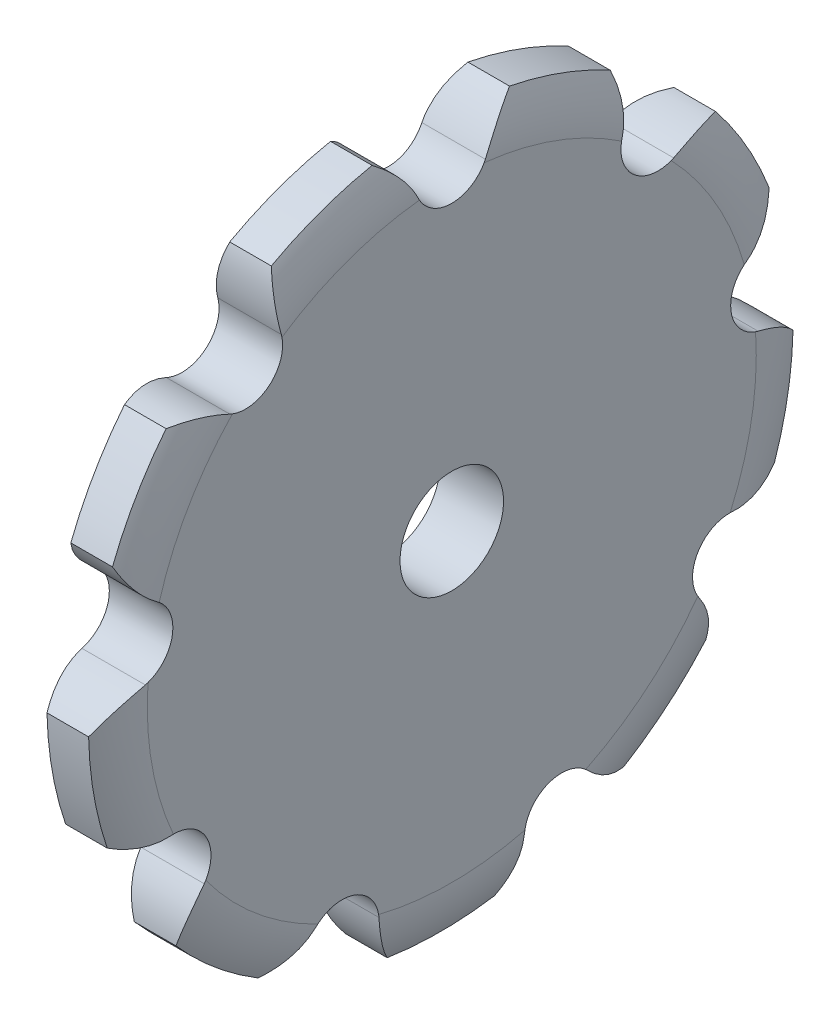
SolidWorks part; units mm, degrees
ref_plane "Plane1" through (0, 0, 0) normal (0, 0, 1) x (1, 0, 0)
ref_plane "Plane2" through (0, 0, 0) normal (0, 1, 0) x (1, 0, 0)
ref_plane "Plane3" through (0, 0, 0) normal (1, 0, 0) x (0, 0, -1)
sketch "Clipboard" plane through (0, 0, 0) normal (0, 1, 0) x (1, 0, 0)
  line L0 (0, 0) -> (25.0873, -3.9734)
  line L1 (-15, 0) -> (100, 0) construction
  line L2 (0, 0) -> (-0.8416, 0.9512)
  line L3 (0, 0) -> (-11.863, 4.5341)
  line L4 (0, 0) -> (3.0618, 0.4849)
  line L5 (0, 0) -> (-2.8109, -1.0484)
  line L6 (0, 0) -> (-6.1032, -4.1179)
  line L7 (-0.8416, 0.9512) -> (9.364, 2.7507)
  line L8 (-76.2, 38.1) -> (-75.2, 38.1)
  line L9 (-73.4361, 41.7391) -> (-72.4443, 41.8673)
  line L10 (-73.4741, 12.7512) -> (-59.5541, 12.7512)
  line L11 (-73.4741, 12.7512) -> (-59.1042, 12.5003)
  line L12 (-147.5013, -35.8225) -> (-147.5932, -35.8997)
  circle A0 centre (0, 0) radius 4.255
  circle A1 centre (0, 0) radius 25
  circle A2 centre (0, 0) radius 25
  dimension "Dr" = 8.51
  dimension "MHD" = 50
  dimension "Hub_dia" = 50
  dimension "Num_teeth" = 9
  dimension "Pitch" = 25.4
  dimension "Width" = 3.1
  dimension "Side_relief" = 1.27
  dimension "Side_radius" = 12.7
  dimension "Overall_len" = 3
  dimension "Show_teeth" = 9
  dimension "Thickness" = 7.3625
  dimension "OAL" = 10.363
  dimension "T_dim" = 1
  dimension "Fillet_rad" = 1
  dimension "Face_width" = 7.363
  dimension "Num_strands" = 1
  dimension "Transv_pitch" = 13.92
  dimension "Plate_wid" = 11.8
  dimension "Cut" = 1
  dimension "GapFactor" = 0.12
  dimension "GapAngle" = 140
sketch "BasProSke" plane through (0, 0, 0) normal (0, 1, 0) x (1, 0, 0)
  line L0 (-10, 0) -> (60, 0) construction
  line L1 (0, 0) -> (0, 35.279)
  line L2 (0, 0) -> (7.3625, 0)
  line L3 (7.3625, 0) -> (7.3625, 35.279)
  line L4 (6.0925, 40.8148) -> (1.27, 40.8148)
  arc A0 (0, 35.279) -> (1.27, 40.8148) centre (12.7, 35.279) cw
  arc A1 (7.3625, 35.279) -> (6.0925, 40.8148) centre (-5.3375, 35.279) ccw
  dimension "D1" = 12.7
  dimension "G1" = 1.27
  dimension "G2" = 1.27
  dimension "Diameter" = 81.6296
  dimension "Thickness" = 7.3625
revolve "Base-Revolve" add sketch "BasProSke" angle 360 about L0
sketch "TooCutSke" plane through (0, 0, 0) normal (1, 0, 0) x (0, 0, -1)
  line L0 (0, 37.1749) -> (3.8949, 35.3586) construction
  line L1 (0, 0) -> (0, 107) construction
  line L2 (0, 37.1749) -> (-10, 37.1749) construction
  line L3 (0, 37.1749) -> (-3.8949, 35.3586) construction
  arc A0 (3.8949, 35.3586) -> (7.9688, 40.0395) centre (14.0756, 30.6113) cw
  arc A1 (3.8949, 35.3586) -> (-3.8949, 35.3586) centre (0, 37.1749) cw
  arc A2 (-3.8949, 35.3586) -> (-7.9688, 40.0395) centre (-14.0756, 30.6113) ccw
  arc A3 (7.9688, 40.0395) -> (-7.9688, 40.0395) centre (0, 0) ccw
  dimension "R1" = 4.2976
  dimension "R2" = 11.2332
  dimension "Overcut" = 40.8248
  dimension "Seat_radius" = 37.1749
  dimension "X" = 130
extrude "ToothCut" cut sketch "TooCutSke" along normal through all
pattern_circular "TeethCuts" count 9 every 40 about axis through (-10, 0, 0) along (1, 0, 0) of "ToothCut"
sketch "HubNeaOneSke" plane through (0, 0, 0) normal (-1, 0, 0) x (0, 0, 1)
  circle A0 centre (0, 0) radius 25
  dimension "Diameter" = 50
extrude "HubNearOne" [suppressed] add sketch "HubNeaOneSke" along normal blind 3.0005
fillet "HubNearOneFillet" [suppressed] radius 1
sketch "HubNeaBotSke" plane through (0, 0, 0) normal (-1, 0, 0) x (0, 0, 1)
  circle A0 centre (0, 0) radius 25
  dimension "Diameter" = 50
extrude "HubNearBoth" [suppressed] add sketch "HubNeaBotSke" along normal blind 1.5003
fillet "HubNearBothFillet" [suppressed] radius 1
ref_plane "FarPln" through (7.3625, 0, 0) normal (1, 0, 0) x (0, 0, -1)
sketch "HubFarSke" plane through (7.3625, 0, 0) normal (1, 0, 0) x (0, 0, -1)
  circle A0 centre (0, 0) radius 25
  dimension "Diameter" = 50
extrude "HubFar" [suppressed] add sketch "HubFarSke" along normal blind 1.5003
fillet "HubFarFillet" [suppressed] radius 1
sketch "BorSke" plane through (0, 0, 0) normal (1, 0, 0) x (0, 0, -1)
  circle A0 centre (0, 0) radius 6
  dimension "Diameter" = 12
extrude "Bore" cut sketch "BorSke" along normal mid plane 20.726
sketch "KeySke" plane through (0, 0, 0) normal (1, 0, 0) x (0, 0, -1)
  line L0 (-1, 0) -> (-1, 7)
  line L1 (-1, 7) -> (1, 7)
  line L2 (1, 7) -> (1, 0)
  line L3 (0, 0) -> (0, 34) construction
  line L4 (-1, 0) -> (1, 0)
  dimension "Offset" = 7
  dimension "Width" = 2
extrude "Keyway" [suppressed] cut sketch "KeySke" along normal mid plane 20.726
pattern_circular "Keyway2" [suppressed] count 2 every 90 about axis through (-10, 0, 0) along (1, 0, 0)
equation "' \"Pitch@Clipboard\" = 25.4"
equation "' \"Num_teeth@Clipboard\" = 9"
equation "' \"Hub_dia@Clipboard\" = 50"
equation "' \"Overall_len@Clipboard\" = 3"
equation "' \"Diameter@BorSke\" = 12"
equation "' \"T_dim@Clipboard\" = 1"
equation "' \"Width@KeySke\" = 2"
equation "' \"Dr@Clipboard\" = 8.51"
equation "' \"Face_width@Clipboard\" = 7.3625"
equation "' \"Side_radius@Clipboard\" = 12.7"
equation "' \"Side_relief@Clipboard\" = 1.27"
equation "' \"Show_teeth@Clipboard\" = 9"
equation "' \"Fillet_rad@Clipboard\" = 1"
equation "' \"Plate_wid@Clipboard\" = 11.8"
equation "'  \"Cut@Clipboard\" = 1"
equation "'  \"GapAngle@Clipboard\" = 140"
equation "'  \"GapFactor@Clipboard\" = 0.12"
equation "' \"Num_teeth@Clipboard\" = int( \"Num_teeth@Clipboard\" )"
equation "\"Num_teeth@Clipboard\" = ((sgn( \"Num_teeth@Clipboard\" - 5.0)+1)*( \"Num_teeth@Clipboard\" - 5.0))/2 +5.0"
equation "\"Num_teeth@Clipboard\" = ((sgn( \"Num_teeth@Clipboard\" - 200.0)-1)*( \"Num_teeth@Clipboard\" - 200.0))/-2 +200.0"
equation "\"MHD@Clipboard\" = \"Pitch@Clipboard\" * (1.0 / tan(3.14159265 / \"Num_teeth@Clipboard\" )) - 1.05 * \"Plate_wid@Clipboard\" - 2.0 * \"Fillet_rad@Clipboard\" - 1.0"
equation "\"Thickness@Clipboard\"  = \"Face_width@Clipboard\" + (\"Num_strands@Clipboard\" - 1) * \"Transv_pitch@Clipboard\""
equation "\"OAL@Clipboard\" = \"Thickness@Clipboard\" + 2 * \"Fillet_rad@Clipboard\" + 1"
equation "\"MHD@Clipboard\" = ((sgn( \"MHD@Clipboard\" - \"Hub_dia@Clipboard\" )-1)*( \"MHD@Clipboard\" - \"Hub_dia@Clipboard\" ))/-2+ \"Hub_dia@Clipboard\""
equation "\"OAL@Clipboard\" = ((sgn( \"OAL@Clipboard\" - \"Overall_len@Clipboard\" )+1)*( \"OAL@Clipboard\" - \"Overall_len@Clipboard\" ))/2 + \"Overall_len@Clipboard\" + 0.0005"
equation "\"Num_teeth@TeethCuts\" = int( \"Show_teeth@Clipboard\" ) + 1"
equation "\"Num_teeth@TeethCuts\" = ((sgn( \"Num_teeth@TeethCuts\" - \"Num_teeth@Clipboard\" )-1)*( \"Num_teeth@TeethCuts\" - \"Num_teeth@Clipboard\" ))/-2+ \"Num_teeth@Clipboard\""
equation "\"Num_teeth@TeethCuts\" = ((sgn( \"Num_teeth@TeethCuts\" - 2.0)+1)*( \"Num_teeth@TeethCuts\" - 2.0))/2 +2.0"
equation "\"Angle@TeethCuts\" = 360.0 / \"Num_teeth@Clipboard\""
equation "\"Num_teeth@TeethCuts\" = \"Num_teeth@TeethCuts\" * \"Cut@Clipboard\""
equation "\"Angle@TeethCuts\" = \"Angle@TeethCuts\" / \"Cut@Clipboard\""
equation "\"Seat_radius@TooCutSke\" = ( \"Pitch@Clipboard\" / 2.0) / sin(3.14159265 / \"Num_teeth@Clipboard\" ) - \"Dr@Clipboard\" / 2.0 + \"Dr@Clipboard\" * 0.505"
equation "\"R1@TooCutSke\"  = \"Dr@Clipboard\" * 0.505"
equation "\"X@TooCutSke\" = \"GapAngle@Clipboard\" - (90.0 / \"Num_teeth@Clipboard\")"
equation "\"R2@TooCutSke\" = \"GapFactor@Clipboard\"  * \"Dr@Clipboard\" * ( \"Num_teeth@Clipboard\" + 2.0)"
equation "' \"R2@TooCutSke\" = 0.008 * \"Dr@Clipboard\" * ( \"Num_teeth@Clipboard\" * \"Num_teeth@Clipboard\" + 180)"
equation "\"Overcut@TooCutSke\" = 0.01 + 0.625 / 2 * \"Pitch@Clipboard\" - 0.5 * \"Dr@Clipboard\"  +  \"Pitch@Clipboard\" / 2.0 / sin(3.14159265 / \"Num_teeth@Clipboard\" )"
equation "\"Diameter@BasProSke\" = 2.0 * ( 0.625 / 2 * \"Pitch@Clipboard\" - 0.5 * \"Dr@Clipboard\"  +  \"Pitch@Clipboard\" / 2.0 / sin(3.14159265 / \"Num_teeth@Clipboard\" ))"
equation "\"Thickness@BasProSke\"  = \"Thickness@Clipboard\""
equation "\"G1@BasProSke\" =  \"Side_relief@Clipboard\""
equation "\"G2@BasProSke\" =  \"Side_relief@Clipboard\""
equation "\"D1@BasProSke\" =  \"Side_radius@Clipboard\""
equation "\"Diameter@HubNeaOneSke\" = \"MHD@Clipboard\""
equation "\"Length@HubNearOne\" = \"OAL@Clipboard\" - \"Thickness@BasProSke\""
equation "\"Diameter@HubNeaBotSke\" = \"MHD@Clipboard\""
equation "\"Length@HubNearBoth\" = ( \"OAL@Clipboard\" - \"Thickness@BasProSke\" ) / 2.0"
equation "\"D1@HubNearOneFillet\" = \"Fillet_rad@Clipboard\""
equation "\"D1@HubNearBothFillet\" = \"Fillet_rad@Clipboard\""
equation "\"Thickness@FarPln\" = \"Thickness@BasProSke\""
equation "\"Diameter@HubFarSke\" = \"MHD@Clipboard\""
equation "\"Length@HubFar\" = ( \"OAL@Clipboard\" - \"Thickness@BasProSke\" ) / 2.0"
equation "\"D1@HubFarFillet\" = \"Fillet_rad@Clipboard\""
equation "\"D1@Bore\" = \"OAL@Clipboard\" * 2.0"
equation "\"D1@Keyway\" = \"OAL@Clipboard\" * 2.0"
equation "\"Offset@KeySke\" = \"T_dim@Clipboard\" + \"Diameter@BorSke\" / 2.0"
